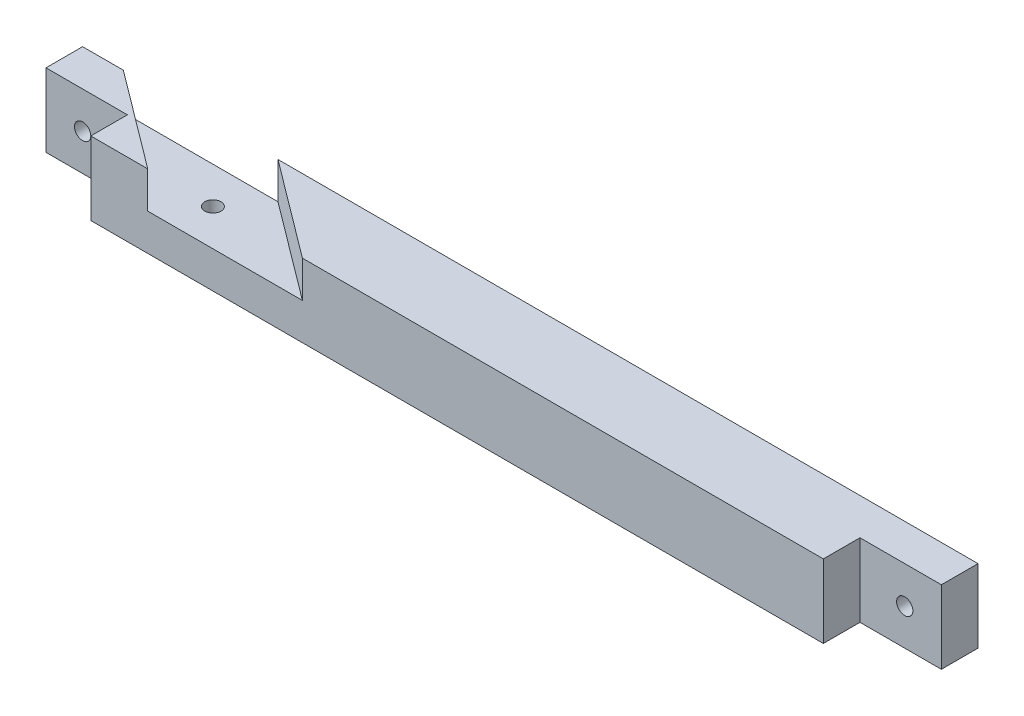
SolidWorks part; units mm, degrees
ref_plane "Face" through (0, 0, 0) normal (0, 0, 1) x (1, 0, 0)
ref_plane "Dessus" through (0, 0, 0) normal (0, 1, 0) x (1, 0, 0)
ref_plane "Droite" through (0, 0, 0) normal (1, 0, 0) x (0, 0, -1)
sketch "Esquisse1" plane through (0, 0, 0) normal (0, 0, 1) x (1, 0, 0)
  line L1 (-67.2717, -109.6176) -> (42.7283, -109.6176)
  line L2 (-67.2717, -109.6176) -> (-67.2717, -100.6176)
  line L3 (-67.2717, -100.6176) -> (42.7283, -100.6176)
  line L4 (42.7283, -109.6176) -> (42.7283, -100.6176)
  dimension "D1" = 110
  dimension "D2" = 9
extrude "Extrusion1" add sketch "Esquisse1" along normal blind 9
sketch "Esquisse2" plane through (0, 0, 9) normal (0, 0, 1) x (1, 0, 0)
  line L0 (42.7283, -100.6176) -> (-67.2717, -100.6176) construction
  line L1 (-67.2717, -109.6176) -> (-57.2717, -109.6176)
  line L2 (-67.2717, -109.6176) -> (-67.2717, -100.6176)
  line L3 (-67.2717, -100.6176) -> (-57.2717, -100.6176)
  line L4 (-57.2717, -109.6176) -> (-57.2717, -100.6176)
  line L6 (42.7283, -109.6176) -> (32.7283, -109.6176)
  line L7 (42.7283, -109.6176) -> (42.7283, -100.6176)
  line L8 (42.7283, -100.6176) -> (32.7283, -100.6176)
  line L9 (32.7283, -109.6176) -> (32.7283, -100.6176)
  dimension "D1" = 10
  dimension "D2" = 10
extrude "Enlèv. mat.-Extru.1" cut sketch "Esquisse2" against normal blind 4.5
sketch "Esquisse4" plane through (0, 0, 4.5) normal (0, 0, 1) x (1, 0, 0)
  line L0 (42.7283, -109.6176) -> (42.7283, -100.6176) construction
  line L1 (32.7283, -109.6176) -> (42.7283, -109.6176) construction
  circle A0 centre (38.2284, -105.1454) radius 1
  point P2 (42.7283, -105.1176)
  point P5 (37.7283, -109.6176)
  dimension "D3" = 2
  dimension "D1" = 4.5
  dimension "D2" = 4.5
extrude "Enlèv. mat.-Extru.2" cut sketch "Esquisse4" against normal blind 4.5
sketch "Esquisse5" plane through (0, 0, 4.5) normal (0, 0, 1) x (1, 0, 0)
  line L0 (-67.2717, -109.6176) -> (-57.2717, -109.6176) construction
  line L1 (-67.2717, -100.6176) -> (-67.2717, -109.6176) construction
  circle A0 centre (-62.7717, -105.1176) radius 1
  dimension "D1" = 2
  dimension "D2" = 4.5
  dimension "D3" = 4.5
extrude "Enlèv. mat.-Extru.3" cut sketch "Esquisse5" against normal blind 4.5
sketch "Esquisse6" plane through (0, -100.6176, 0) normal (0, 1, 0) x (1, 0, 0)
  line L0 (-62.2717, 0) -> (-43.2717, 0)
  line L1 (42.7283, 0) -> (-67.2717, 0) construction
  line L2 (-43.2717, 0) -> (-31.2717, -9)
  line L3 (32.7283, -9) -> (-57.2717, -9) construction
  line L4 (-31.2717, -9) -> (-50.2717, -9)
  line L5 (-50.2717, -9) -> (-62.2717, 0)
  dimension "D1" = 5
  dimension "D2" = 19
  dimension "D3" = 36
  dimension "D4" = 19
extrude "Enlèv. mat.-Extru.4" cut sketch "Esquisse6" against normal blind 4.5
sketch "Esquisse7" plane through (0, -105.1176, 0) normal (0, 1, 0) x (1, 0, 0)
  line L0 (-50.2717, -9) -> (-43.2717, 0) construction
  line L1 (-43.2717, 0) -> (-31.2717, -9) construction
  line L2 (-31.2717, -9) -> (-61.7717, -0.375) construction
  circle A0 centre (-46.7717, -4.5) radius 1
  dimension "D1" = 2
extrude "Enlèv. mat.-Extru.5" cut sketch "Esquisse7" against normal blind 4.5
